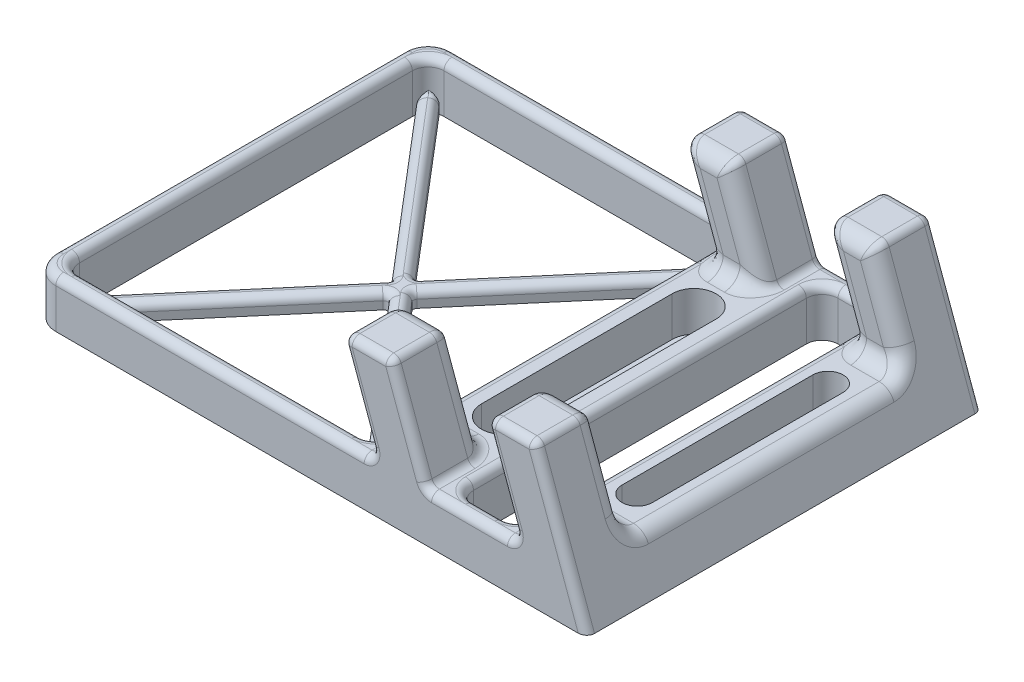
SolidWorks part; units mm, degrees
ref_plane "Plan de face" through (0, 0, 0) normal (0, 0, 1) x (1, 0, 0)
ref_plane "Plan de dessus" through (0, 0, 0) normal (0, 1, 0) x (1, 0, 0)
ref_plane "Plan de droite" through (0, 0, 0) normal (1, 0, 0) x (0, 0, -1)
sketch "Esquisse1" plane through (0, 0, 0) normal (0, 0, 1) x (1, 0, 0)
  line L0 (0, 0) -> (-70, 0)
  line L1 (-70, 0) -> (-70, 6)
  line L2 (-70, 6) -> (-26.6599, 6)
  line L3 (-26.6599, 6) -> (-31.0276, 18)
  line L4 (-31.0276, 18) -> (-24.6425, 18)
  line L5 (-24.6425, 18) -> (-20.2748, 6)
  line L6 (-20.2748, 6) -> (-8.5689, 6)
  line L7 (-8.5689, 6) -> (-12.9365, 18)
  line L8 (-12.9365, 18) -> (-6.5515, 18)
  line L9 (-6.5515, 18) -> (0, 0)
  line L10 (-20.2748, 6) -> (-71.5779, 146.9539) construction
  line L11 (-71.5779, 146.9539) -> (-62.9935, 150.0783) construction
  line L12 (-62.9935, 150.0783) -> (-10.5533, 6) construction
  line L13 (-10.5533, 6) -> (-20.2748, 6) construction
  dimension "D1" = 11
  dimension "D2" = 6
  dimension "D3" = 150
  dimension "D4" = 6
  dimension "D5" = 70
  dimension "D6" = 70
  dimension "D7" = 12
extrude "Boss.-Extru.1" add sketch "Esquisse1" along normal blind 50
sketch "Esquisse2" plane through (0, 6, 0) normal (0, 1, 0) x (1, 0, 0)
  line L8 (-28.6599, -2) -> (-68, -2)
  line L9 (-68, -2) -> (-68, -48)
  line L10 (-68, -48) -> (-28.6599, -48)
  line L11 (-28.6599, -48) -> (-28.6599, -2)
  line L12 (-28.6599, -2) -> (-68, -2)
  line L13 (-68, -2) -> (-68, -48)
  line L14 (-68, -48) -> (-28.6599, -48)
  line L15 (-28.6599, -48) -> (-28.6599, -2)
  line L20 (-10.5689, -2) -> (-18.2748, -2)
  line L21 (-18.2748, -2) -> (-18.2748, -48)
  line L22 (-18.2748, -48) -> (-10.5689, -48)
  line L23 (-10.5689, -48) -> (-10.5689, -2)
  line L24 (-10.5689, -2) -> (-18.2748, -2)
  line L25 (-18.2748, -2) -> (-18.2748, -48)
  line L26 (-18.2748, -48) -> (-10.5689, -48)
  line L27 (-10.5689, -48) -> (-10.5689, -2)
  dimension "D1" = 2
  dimension "D2" = 2
extrude "Enlèv. mat.-Extru.1" cut sketch "Esquisse2" against normal blind 50
fillet "Congé1" radius 2 8 edges at (-68, 3, 48) (-28.6599, 3, 48) (-28.6599, 3, 2) (-68, 3, 2) (-18.2748, 3, 48) (-10.5689, 3, 48) (-10.5689, 3, 2) (-18.2748, 3, 2)
fillet "Congé2" radius 1 7 edges at (-31.0276, 18, 25) (-24.6425, 18, 25) (-12.9365, 18, 25) (-6.5515, 18, 25) (-20.2748, 6, 25) (-8.5689, 6, 25) (-26.6599, 6, 25)
fillet "Congé3" radius 3 2 edges at (-70, 3, 50) (-70, 3, 0)
fillet "Congé4" radius 1 33 edges at (-3.156, 8.671, 50) (-6.6781, 17.8192, 50) (-9.38, 18, 50) (-12.3275, 17.5736, 50) (-10.7527, 12, 50) (-9.1779, 6.4264, 50) (-14.7858, 6, 50) (-20.1482, 6.1808, 50) (-22.4587, 12, 50) (-24.7691, 17.8192, 50) (-27.471, 18, 50) (-30.4186, 17.5736, 50) (-28.8437, 12, 50) (-27.2689, 6.4264, 50) (-47.544, 6, 50) (-69.1213, 6, 49.1213) (-70, 6, 25) (-69.1213, 6, 0.8787) (-47.544, 6, 0) (-27.2689, 6.4264, 0) (-28.8437, 12, 0) (-30.4186, 17.5736, 0) (-27.471, 18, 0) (-24.7691, 17.8192, 0) (-22.4587, 12, 0) (-20.1482, 6.1808, 0) (-14.7858, 6, 0) (-9.1779, 6.4264, 0) (-10.7527, 12, 0) (-12.3275, 17.5736, 0) (-9.38, 18, 0) (-6.6781, 17.8192, 0) (-3.156, 8.671, 0)
sketch "Esquisse3" plane through (-68, 0, 0) normal (1, 0, 0) x (0, 0, -1)
  line L0 (-25, 0) -> (-25, 25.6864) construction
  line L1 (-49, 0) -> (-1, 0) construction
  line L2 (-49, 18) -> (-1, 18) construction
  line L3 (-42.5, 18) -> (-7.5, 18)
  line L4 (-42.5, 18) -> (-42.5, 6)
  line L5 (-42.5, 6) -> (-7.5, 6)
  line L6 (-7.5, 18) -> (-7.5, 6)
  dimension "D1" = 35
  dimension "D2" = 12
extrude "Enlèv. mat.-Extru.2" cut sketch "Esquisse3" along normal through all
sketch "Esquisse4" plane through (0, 0, 0) normal (0, -1, 0) x (1, 0, 0)
  line L0 (-67.4142, 47.4142) -> (-29.2457, 2.5858) construction
  line L1 (-67.9394, 46.4885) -> (-49.6433, 25)
  line L2 (-66.5371, 47.9265) -> (-48.33, 26.5425)
  line L3 (-29.2457, 47.4142) -> (-67.4142, 2.5858) construction
  line L4 (-30.1229, 47.9265) -> (-48.33, 26.5425)
  line L5 (-28.7205, 46.4885) -> (-47.0166, 25)
  line L6 (-49.6433, 25) -> (-67.9394, 3.5115)
  line L7 (-68.1756, 46.7659) -> (-30.0071, 1.9375) construction
  line L8 (-66.6528, 48.0625) -> (-28.4843, 3.2341) construction
  line L9 (-48.33, 23.4575) -> (-30.1229, 2.0735)
  line L10 (-30.0071, 48.0625) -> (-68.1756, 3.2341) construction
  line L11 (-48.33, 23.4575) -> (-66.5371, 2.0735)
  line L12 (-47.0166, 25) -> (-28.7205, 3.5115)
  line L13 (-28.4843, 46.7659) -> (-66.6528, 1.9375) construction
  arc A0 (-66, 48) -> (-68, 46) centre (-66, 46) ccw construction
  arc A1 (-30.6599, 2) -> (-28.6599, 4) centre (-30.6599, 4) ccw construction
  arc A2 (-28.6599, 46) -> (-30.6599, 48) centre (-30.6599, 46) ccw construction
  arc A3 (-68, 4) -> (-66, 2) centre (-66, 4) ccw construction
  arc A4 (-67.9394, 3.5115) -> (-66.5371, 2.0735) centre (-66, 4) ccw
  arc A5 (-30.1229, 2.0735) -> (-28.7205, 3.5115) centre (-30.6599, 4) ccw
  arc A6 (-28.7205, 46.4885) -> (-30.1229, 47.9265) centre (-30.6599, 46) ccw
  arc A7 (-66.5371, 47.9265) -> (-67.9394, 46.4885) centre (-66, 46) ccw
  dimension "D1" = 1
  dimension "D2" = 1
  dimension "D3" = 1
  dimension "D4" = 1
extrude "Boss.-Extru.2" add sketch "Esquisse4" against normal blind 2
fillet "Congé7" radius 0.5 8 edges at (-48.33, 1, 26.5425) (-49.6433, 1, 25) (-48.33, 1, 23.4575) (-47.0166, 1, 25) (-67.4319, 2, 47.3963) (-67.4319, 2, 2.6037) (-29.2281, 2, 2.6037) (-29.2281, 2, 47.3963)
fillet "Congé8" radius 2 31 edges at (-9.1779, 6.4264, 7.5) (-10.7527, 12, 7.5) (-12.3275, 17.5736, 7.5) (-9.38, 18, 7.5) (-6.6781, 17.8192, 7.5) (-4.2479, 11.671, 7.5) (-2.1838, 6, 25) (-24.7691, 17.8192, 7.5) (-22.4587, 12, 7.5) (-20.1482, 6.1808, 7.5) (-23.8313, 6, 7.5) (-27.2689, 6.4264, 7.5) (-28.8437, 12, 7.5) (-30.4186, 17.5736, 7.5) (-27.471, 18, 7.5) (-24.7691, 17.8192, 42.5) (-27.471, 18, 42.5) (-30.4186, 17.5736, 42.5) (-28.8437, 12, 42.5) (-27.2689, 6.4264, 42.5) (-23.8313, 6, 42.5) (-20.1482, 6.1808, 42.5) (-22.4587, 12, 42.5) (-6.6781, 17.8192, 42.5) (-9.38, 18, 42.5) (-12.3275, 17.5736, 42.5) (-10.7527, 12, 42.5) (-9.1779, 6.4264, 42.5) (-6.0904, 6, 42.5) (-4.2479, 11.671, 42.5) (-6.0904, 6, 7.5)
fillet "Congé9" radius 1 16 edges at (-11.1547, 6, 2.5858) (-10.5689, 6, 25) (-11.1547, 6, 47.4142) (-14.4219, 6, 48) (-17.6891, 6, 47.4142) (-18.2748, 6, 25) (-17.6891, 6, 2.5858) (-29.2457, 6, 2.5858) (-28.6599, 6, 25) (-29.2457, 6, 47.4142) (-48.33, 6, 48) (-67.4142, 6, 47.4142) (-68, 6, 25) (-67.4142, 6, 2.5858) (-14.4219, 6, 2) (-48.33, 6, 2)
fillet "Congé10" radius 1 20 edges at (-66.4709, 2.2108, 2.1512) (-30.2299, 2.1443, 2.1992) (-28.7823, 2.2337, 3.584) (-28.8366, 2.1499, 46.3521) (-30.189, 2.2108, 47.8488) (-66.43, 2.1443, 47.8008) (-67.8776, 2.2337, 46.416) (-67.8233, 2.1499, 3.6479) (-49.8, 2, 25) (-58.7095, 2, 14.3519) (-57.4383, 2, 12.7598) (-48.33, 2, 23.1862) (-39.2216, 2, 12.7598) (-37.9504, 2, 14.3519) (-46.8599, 2, 25) (-37.9504, 2, 35.6481) (-39.2216, 2, 37.2402) (-48.33, 2, 26.8138) (-57.4383, 2, 37.2402) (-58.7095, 2, 35.6481)
sketch "Esquisse5" plane through (0, 6, 0) normal (0, 1, 0) x (1, 0, 0)
  line L0 (-23.4674, -12.9617) -> (-23.4674, -37.0383) construction
  line L1 (-20.6975, -12.9617) -> (-20.6975, -37.0383)
  line L2 (-26.2372, -12.9617) -> (-26.2372, -37.0383)
  line L3 (-28.6599, -42.1183) -> (-28.6599, -7.8817) construction
  line L4 (-18.2748, -4) -> (-18.2748, -46) construction
  line L5 (-68, -25) -> (0, -25) construction
  line L6 (-68, -4) -> (-68, -46) construction
  line L7 (0, -49) -> (0, -1) construction
  line L8 (-6.5766, -12.9617) -> (-6.5766, -37.0383) construction
  line L9 (-4.659, -12.9617) -> (-4.659, -37.0383)
  line L10 (-8.4942, -12.9617) -> (-8.4942, -37.0383)
  line L11 (-9.5689, -7.8819) -> (-9.5689, -42.1181) construction
  line L12 (-3.5842, -40.5) -> (-3.5842, -9.5) construction
  arc A0 (-20.6975, -12.9617) -> (-26.2372, -12.9617) centre (-23.4674, -12.9617) ccw
  arc A1 (-26.2372, -37.0383) -> (-20.6975, -37.0383) centre (-23.4674, -37.0383) ccw
  arc A2 (-4.659, -12.9617) -> (-8.4942, -12.9617) centre (-6.5766, -12.9617) ccw
  arc A3 (-8.4942, -37.0383) -> (-4.659, -37.0383) centre (-6.5766, -37.0383) ccw
  point P2 (-23.4674, -25)
  point P17 (-6.5766, -25)
  point P24 (-6.6976, -25)
extrude "Enlèv. mat.-Extru.3" cut sketch "Esquisse5" against normal offset from surface (5 mm away) 1
